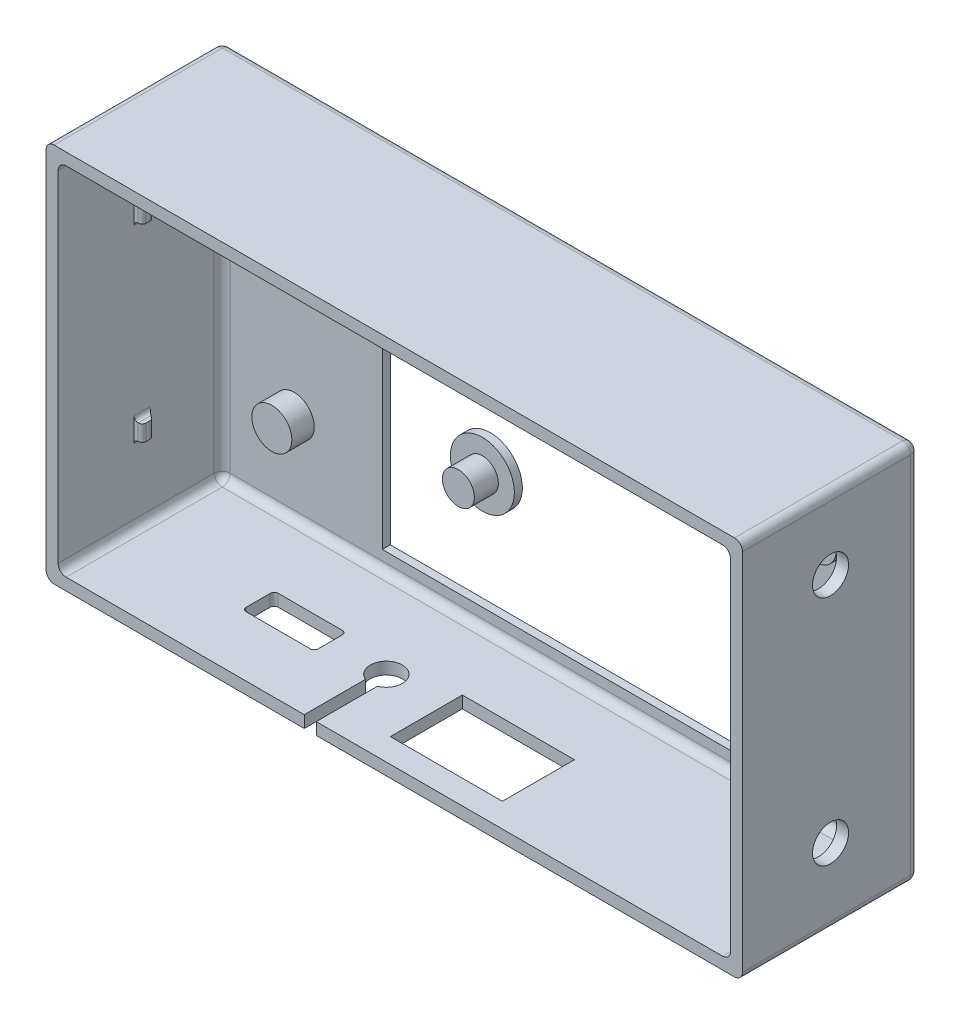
SolidWorks part; units mm, degrees
ref_plane "Спереди" through (0, 0, 0) normal (0, 0, 1) x (1, 0, 0)
ref_plane "Сверху" through (0, 0, 0) normal (0, 1, 0) x (1, 0, 0)
ref_plane "Справа" through (0, 0, 0) normal (1, 0, 0) x (0, 0, -1)
other "Configuration Table"
sketch "Эскиз1" plane through (0, 0, 0) normal (0, 0, 1) x (1, 0, 0)
  line L1 (43.5, 23.75) -> (-43.5, 23.75)
  line L2 (43.5, 23.75) -> (43.5, -23.75)
  line L3 (43.5, -23.75) -> (-43.5, -23.75)
  line L4 (-43.5, 23.75) -> (-43.5, -23.75)
  line L5 (43.5, 23.75) -> (-43.5, -23.75) construction
  line L6 (43.5, -23.75) -> (-43.5, 23.75) construction
  line L7 (-22, 20) -> (30, 20)
  line L8 (-22, 20) -> (-22, -20)
  line L9 (-22, -20) -> (30, -20)
  line L10 (30, 20) -> (30, -20)
  circle A0 centre (-53.5916, 14.6011) radius 4
  circle A1 centre (-53.4891, 1.3179) radius 4
  point P0 (0, 0)
  dimension "D7" = 8
  dimension "D8" = 8
  dimension "D1" = 87
  dimension "D2" = 47.5
  dimension "D3" = 21.5
  dimension "D4" = 52
  dimension "D5" = 40
  dimension "D6" = 3.75
extrude "Бобышка-Вытянуть1" add sketch "Эскиз1" along normal blind 22
sketch "Эскиз2" plane through (0, 0, 22) normal (0, 0, 1) x (1, 0, 0)
  line L1 (-43.5, 23.75) -> (-43.5, -23.75) construction
  line L2 (42, -22.25) -> (-42, -22.25)
  line L3 (42, -22.25) -> (42, 22.25)
  line L4 (42, 22.25) -> (-42, 22.25)
  line L5 (-42, -22.25) -> (-42, 22.25)
  line L6 (42, -22.25) -> (-42, 22.25) construction
  line L7 (42, 22.25) -> (-42, -22.25) construction
  line L8 (43.5, 23.75) -> (-43.5, 23.75) construction
  point P2 (0, 0)
  dimension "D1" = 1.5
  dimension "D2" = 1.5
extrude "Вырез-Вытянуть1" cut sketch "Эскиз2" against normal blind 20.5
sketch "Эскиз4" plane through (43.5, 0, 0) normal (1, 0, 0) x (0, 0, -1)
  line L0 (-11, 23.75) -> (-11, -23.75) construction
  line L1 (-22, 23.75) -> (0, 23.75) construction
  line L2 (-22, -23.75) -> (0, -23.75) construction
  line L3 (0, -23.75) -> (0, 23.75) construction
  circle A0 centre (-11, 14.75) radius 2.25
  circle A1 centre (-11, -14.25) radius 2.25
  dimension "D4" = 4.5
  dimension "D5" = 4.5
  dimension "D1" = 11
  dimension "D2" = 9.5
  dimension "D3" = 29
extrude "Вырез-Вытянуть2" cut sketch "Эскиз4" against normal blind 10
sketch "Эскиз5" plane through (0, 0, 1.5) normal (0, 0, 1) x (1, 0, 0)
  line L0 (-33, 22.25) -> (-33, -22.25) construction
  line L1 (42, 22.25) -> (-42, 22.25) construction
  line L2 (-42, -22.25) -> (42, -22.25) construction
  line L3 (35, 22.25) -> (35, -22.25) construction
  line L4 (42, 22.25) -> (-42, 22.25) construction
  line L5 (30, -20) -> (30, 20) construction
  line L6 (-22, -20) -> (30, -20) construction
  line L7 (30, 20) -> (-22, 20) construction
  line L8 (-22, 20) -> (-22, -20) construction
  line L9 (35, 11) -> (-33, 11) construction
  line L10 (35, -11) -> (-33, -11) construction
  circle A0 centre (35, 11) radius 2.5
  circle A1 centre (35, -11) radius 2.5
  circle A2 centre (-33, 11) radius 2.5
  circle A3 centre (-33, -11) radius 2.5
  dimension "D4" = 5
  dimension "D5" = 5
  dimension "D7" = 5
  dimension "D8" = 5
  dimension "D1" = 5
  dimension "D2" = 9
  dimension "D3" = 9
  dimension "D6" = 11
extrude "Бобышка-Вытянуть2" add sketch "Эскиз5" along normal blind 2.8
fillet "Скругление1" radius 1 16 edges at (0, 22.25, 1.5) (0, -22.25, 1.5) (42, 0, 1.5) (-42, 0, 1.5) (-42, 22.25, 11.75) (-42, -22.25, 11.75) (42, -22.25, 11.75) (42, 22.25, 11.75) (-43.5, -23.75, 11) (-43.5, 23.75, 11) (-43.5, 0, 0) (0, -23.75, 0) (43.5, 0, 0) (43.5, 23.75, 11) (0, 23.75, 0) (43.5, -23.75, 11)
chamfer "Фаска1" distance 0.5 angle 45 4 edges at (30, 0, 0) (4, 20, 0) (-22, 0, 0) (4, -20, 0)
sketch "Эскиз7" plane through (0, 0, 22) normal (0, 0, 1) x (1, 0, 0)
  line L1 (-59.344, 26.8591) -> (-47.7292, 26.8591)
  line L2 (-59.344, 26.8591) -> (-59.344, -9.772)
  line L3 (-59.344, -9.772) -> (-47.7292, -9.772)
  line L4 (-47.7292, 26.8591) -> (-47.7292, -9.772)
  line L5 (-59.344, 26.8591) -> (-47.7292, -9.772) construction
  line L6 (-59.344, -9.772) -> (-47.7292, 26.8591) construction
  point P0 (-53.5366, 8.5435)
extrude "Вырез-Вытянуть4" cut sketch "Эскиз7" against normal blind 23
sketch "Эскиз10" plane through (0, -23.75, 0) normal (0, -1, 0) x (1, 0, 0)
  line L0 (-43.5, 1) -> (-43.5, 22) construction
  line L1 (-26.5, 14.5) -> (-17.5, 14.5)
  line L2 (-26.5, 14.5) -> (-26.5, 10.5)
  line L3 (-26.5, 10.5) -> (-17.5, 10.5)
  line L4 (-17.5, 14.5) -> (-17.5, 10.5)
  line L5 (-26.5, 14.5) -> (-17.5, 10.5) construction
  line L6 (-26.5, 10.5) -> (-17.5, 14.5) construction
  line L7 (42.5, 0) -> (-42.5, 0) construction
  line L8 (-14.5167, 10) -> (43.5, 10) construction
  line L9 (43.5, 22) -> (43.5, 1) construction
  line L11 (-3.5, 19) -> (10.5, 19)
  line L12 (-3.5, 19) -> (-3.5, 10)
  line L13 (-3.5, 10) -> (10.5, 10)
  line L14 (10.5, 19) -> (10.5, 10)
  line L15 (-3.5, 19) -> (10.5, 10) construction
  line L16 (-3.5, 10) -> (10.5, 19) construction
  line L17 (-11.25, 22.1441) -> (-9.75, 22.1441)
  line L18 (-11.25, 22.1441) -> (-11.25, 14.354)
  line L20 (-9.75, 22.1441) -> (-9.75, 14.354)
  line L21 (-11.25, 22.1441) -> (-9.75, 13.8559) construction
  line L22 (-11.25, 13.8559) -> (-9.75, 22.1441) construction
  arc A0 (-11.25, 14.354) -> (-9.75, 14.354) centre (-10.5, 12.5) ccw
  point P0 (-22, 12.5)
  point P13 (3.5, 14.5)
  point P20 (-10.5, 18)
  dimension "D9" = 4
  dimension "D1" = 17
  dimension "D2" = 9
  dimension "D3" = 4
  dimension "D4" = 12.5
  dimension "D5" = 10
  dimension "D6" = 14
  dimension "D7" = 9
  dimension "D8" = 14
  dimension "D10" = 1.5
  dimension "D11" = 7
  dimension "D12" = 7
extrude "Вырез-Вытянуть7" cut sketch "Эскиз10" against normal blind 10
fillet "Скругление2" radius 0.5 4 edges at (-17.5, -23, 10.5) (-17.5, -23, 14.5) (-26.5, -23, 10.5) (-26.5, -23, 14.5)
sketch "Эскиз11" plane through (0, 0, 0) normal (0, 0, 1) x (1, 0, 0)
  circle A0 centre (-10, 7.2451) radius 4
  circle A1 centre (0, 7.2451) radius 4
  circle A2 centre (-10, -6.1086) radius 4
  dimension "D1" = 8
  dimension "D2" = 8
  dimension "D5" = 8
  dimension "D3" = 10
  dimension "D4" = 0
extrude "Бобышка-Вытянуть3" add sketch "Эскиз11" along normal blind 1 separate body
sketch "Эскиз12" plane through (0, 0, 1) normal (0, 0, 1) x (1, 0, 0)
  circle A0 centre (-10, 7.2451) radius 2
  circle A1 centre (0, 7.2451) radius 2
  circle A2 centre (-10, -6.1086) radius 2
  dimension "D1" = 4
  dimension "D2" = 4
  dimension "D3" = 4
extrude "Бобышка-Вытянуть4" add sketch "Эскиз12" along normal blind 3
sketch "Эскиз13" plane through (-42, 0, 0) normal (1, 0, 0) x (0, 0, -1)
  line L0 (-1.5, 20) -> (-1.5, -20) construction
  line L1 (-12.5, 13.0508) -> (-10.5, 13.0508)
  line L2 (-12.5, 13.0508) -> (-12.5, 11.0508)
  line L3 (-12.5, 11.0508) -> (-10.5, 11.0508)
  line L4 (-10.5, 13.0508) -> (-10.5, 11.0508)
  line L5 (-12.5, 13.0508) -> (-10.5, 11.0508) construction
  line L6 (-12.5, 11.0508) -> (-10.5, 13.0508) construction
  line L7 (-12.5, -10.5597) -> (-10.5, -10.5597)
  line L8 (-12.5, -10.5597) -> (-12.5, -12.5597)
  line L9 (-12.5, -12.5597) -> (-10.5, -12.5597)
  line L10 (-10.5, -10.5597) -> (-10.5, -12.5597)
  line L11 (-12.5, -10.5597) -> (-10.5, -12.5597) construction
  line L12 (-12.5, -12.5597) -> (-10.5, -10.5597) construction
  point P0 (-11.5, 12.0508)
  point P5 (-11.5, -11.5597)
  point P10 (-10.5, 12.0508)
  dimension "D1" = 9
  dimension "D2" = 9
  dimension "D3" = 2
  dimension "D4" = 2
  dimension "D5" = 2
  dimension "D6" = 2
extrude "Бобышка-Вытянуть5" add sketch "Эскиз13" along normal blind 1
sketch "Эскиз14" plane through (0, -12.5597, 0) normal (0, -1, 0) x (1, 0, 0)
  line L0 (-41, 10.5) -> (-41, 11.3)
  line L1 (-41, 12.5) -> (-41, 10.5) construction
  line L2 (-41, 11.3) -> (-42, 10.5)
  line L3 (-42, 10.5) -> (-41, 10.5)
  dimension "D1" = 0.8
extrude "Вырез-Вытянуть8" cut sketch "Эскиз14" against normal blind 30
fillet "Скругление3" radius 0.5 8 edges at (-42, -10.5597, 11.5) (-42, -12.5597, 11.5) (-41, -11.5597, 11.3) (-41, -11.5597, 12.5) (-42, 13.0508, 11.5) (-42, 11.0508, 11.5) (-41, 12.0508, 12.5) (-41, 12.0508, 11.3)
